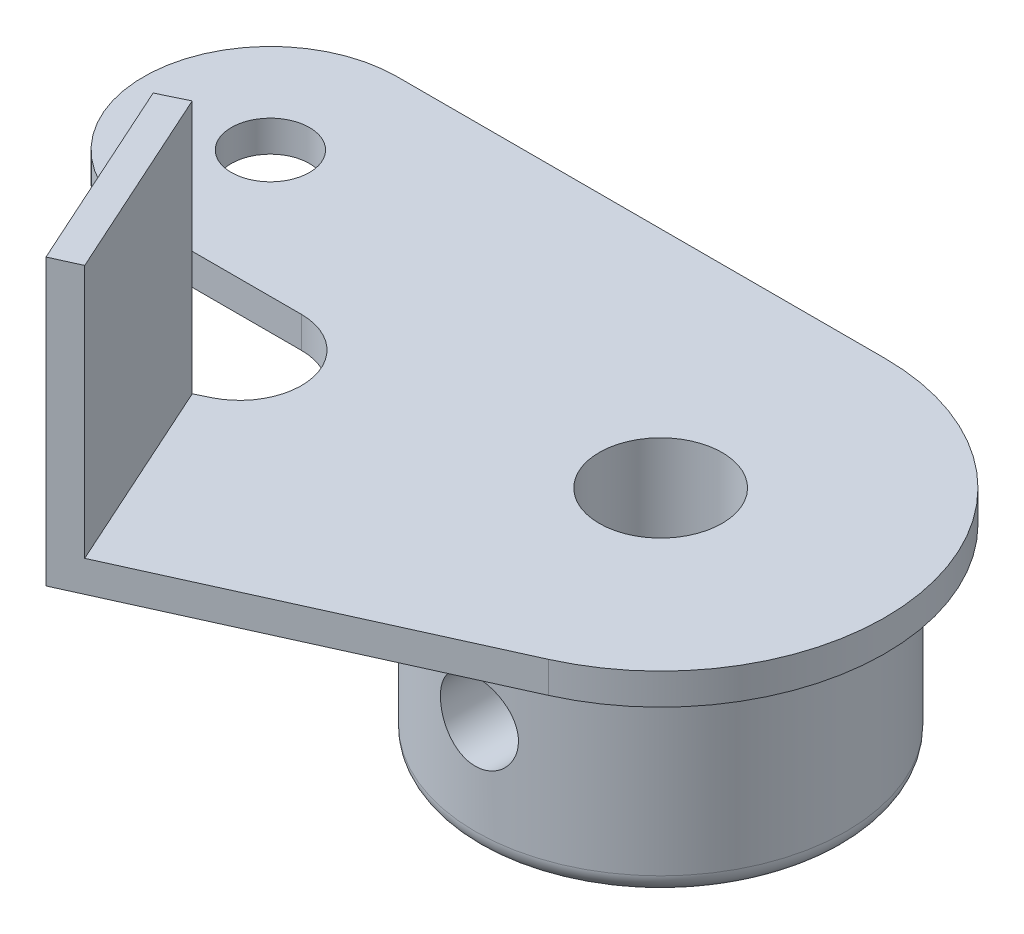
SolidWorks part; units mm, degrees
ref_plane "Plan de face" through (0, 0, 0) normal (0, 0, 1) x (1, 0, 0)
ref_plane "Plan de dessus" through (0, 0, 0) normal (0, 1, 0) x (1, 0, 0)
ref_plane "Plan de droite" through (0, 0, 0) normal (1, 0, 0) x (0, 0, -1)
sketch "Esquisse1" plane through (0, 0, 0) normal (0, 1, 0) x (1, 0, 0)
  line L0 (0, 11.5) -> (-25, 11.5)
  line L1 (-15.5325, -7.5102) -> (-17.5325, -8.4772)
  line L2 (-25, -1.5) -> (-16.9092, -1.5)
  line L3 (4.7385, -10.4784) -> (-13, -18.5)
  line L4 (-17.5325, -8.4772) -> (-13, -18.5)
  arc A0 (4.7385, -10.4784) -> (0, 11.5) centre (0, 0) ccw
  arc A1 (-25, 11.5) -> (-25, -1.5) centre (-25, 5) ccw
  arc A2 (-16.9092, -1.5) -> (-15.5325, -7.5102) centre (-16.9092, -4.6628) cw
  circle A3 centre (0, 0) radius 3.15
  circle A4 centre (-25, 5) radius 2
  point P10 (11.5, 0)
  point P11 (-31.5, 5)
  dimension "D1" = 23
  dimension "D2" = 6.5
  dimension "D8" = 6.3
  dimension "D9" = 4
  dimension "D3" = 43
  dimension "D4" = 13
  dimension "D5" = 30
  dimension "D6" = 2
extrude "Boss.-Extru.1" add sketch "Esquisse1" along normal blind 1.6
sketch "Esquisse2" plane through (0, 1.6, 0) normal (0, 1, 0) x (1, 0, 0)
  circle A0 centre (0, 0) radius 9.5
  circle A1 centre (0, 0) radius 3.15
  dimension "D1" = 19
extrude "Boss.-Extru.2" add sketch "Esquisse2" against normal blind 11.5
fillet "Congé1" radius 1 1 edges at (0, -9.9, 9.5)
sketch "Esquisse3" plane through (0, 1.6, 0) normal (0, 1, 0) x (1, 0, 0)
  line L0 (-17.5325, -8.4772) -> (-13, -18.5)
  line L1 (-13, -18.5) -> (-11.6337, -17.8821)
  line L2 (-16.182, -7.8242) -> (-11.6337, -17.8821)
  line L3 (-13, -18.5) -> (4.7385, -10.4784) construction
  line L4 (-15.5325, -7.5102) -> (-17.5325, -8.4772) construction
  line L5 (-16.182, -7.8242) -> (-17.5325, -8.4772)
  dimension "D1" = 1.5
extrude "Boss.-Extru.3" add sketch "Esquisse3" along normal blind 13
sketch "Esquisse4" plane through (0, 0, 0) normal (0, 0, 1) x (1, 0, 0)
  circle A0 centre (0, -4) radius 2
  dimension "D1" = 4
  dimension "D2" = 4
extrude "Enlèv. mat.-Extru.1" cut sketch "Esquisse4" along normal through all
